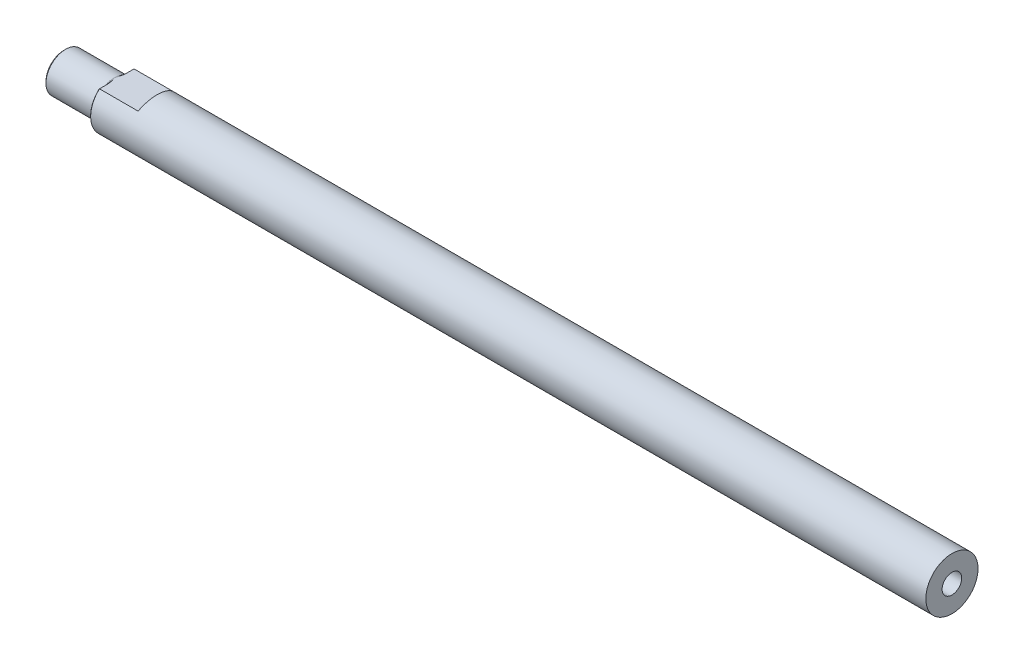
SolidWorks part; units mm, degrees
ref_plane "Front Plane" through (0, 0, 0) normal (0, 0, 1) x (1, 0, 0)
ref_plane "Top Plane" through (0, 0, 0) normal (0, 1, 0) x (1, 0, 0)
ref_plane "Right Plane" through (0, 0, 0) normal (1, 0, 0) x (0, 0, -1)
sketch "Sketch1" plane through (0, 0, 0) normal (0, 0, 1) x (1, 0, 0)
  line L0 (-34.7534, 0) -> (143.7331, 0) construction
  line L1 (-25.4, 9.525) -> (0, 9.525)
  line L2 (0, 9.525) -> (0, 12.7)
  line L3 (0, 12.7) -> (406.4, 12.7)
  line L4 (406.4, 12.7) -> (406.4, 0)
  line L5 (406.4, 0) -> (-25.4, 0)
  line L6 (-25.4, 0) -> (-25.4, 9.525)
  dimension "D1" = 19.05
  dimension "D2" = 25.4
  dimension "D3" = 25.4
  dimension "D4" = 406.4
revolve "Revolve1" add sketch "Sketch1" angle 360 about L0
hole_wizard "1/2-20 Tapped Hole1" positions "Sketch3" profile "Sketch2" tap size "1/2-20" standard "ANSI Inch"
sketch "Sketch3" plane through (-25.4, 0, 0) normal (-1, 0, 0) x (0, 0, 1)
  point P0 (0, 0)
sketch "Sketch2" plane through (-25.4, 0, 0) normal (0, 1, 0) x (0, 0, 1)
  line L0 (0, 0) -> (0, 23.1426)
  line L1 (0, 23.1426) -> (5.7544, 19.685)
  line L2 (5.7544, 19.685) -> (5.7544, 0)
  line L5 (5.7544, 0) -> (0, 0)
  line L10 (0, 23.1426) -> (-5.7544, 19.685) construction
  line L11 (0, -6.35) -> (0, 107.95) construction
  dimension "Tap Drill Dia." = 11.5087
  dimension "Tap Drill Depth" = 19.685
  dimension "Drill Angle" = 118
fillet "Fillet1" radius 0.762 1 edges at (0, 0, 9.525)
sketch "Sketch5" plane through (406.4, 0, 0) normal (1, 0, 0) x (0, 0, -1)
  circle A0 centre (0, 0) radius 4.7625
  dimension "D1" = 9.525
extrude "Cut-Extrude1" cut sketch "Sketch5" against normal through all
sketch "Sketch6" plane through (0, 0, 0) normal (0, 0, 1) x (1, 0, 0)
  line L0 (-1.016, 9.525) -> (19.05, 9.525)
  line L2 (19.05, 9.525) -> (19.9007, 12.7)
  line L3 (406.4, 12.7) -> (0, 12.7) construction
  line L4 (19.9007, 12.7) -> (-1.016, 12.7)
  line L5 (-1.016, 12.7) -> (-1.016, 9.525)
  line L6 (0, -12.7) -> (406.4, -12.7) construction
  dimension "D1" = 75
  dimension "D2" = 22.225
  dimension "D3" = 19.05
  dimension "D4" = 1.016
extrude "Cut-Extrude2" cut sketch "Sketch6" against normal through all both and the other way through all
chamfer "Chamfer1" distance 0.762 angle 45 1 edges at (-25.4, 0, 9.525)
chamfer "Chamfer2" distance 0.254 angle 45 1 edges at (0, -12.7, 0)
chamfer "Chamfer3" distance 0.254 angle 45 4 edges at (0, 9.525, -5.9483) (0, 9.525, 5.9483) (-0.3582, 9.525, -1.4898) (-0.9641, 9.525, 5.5455)
